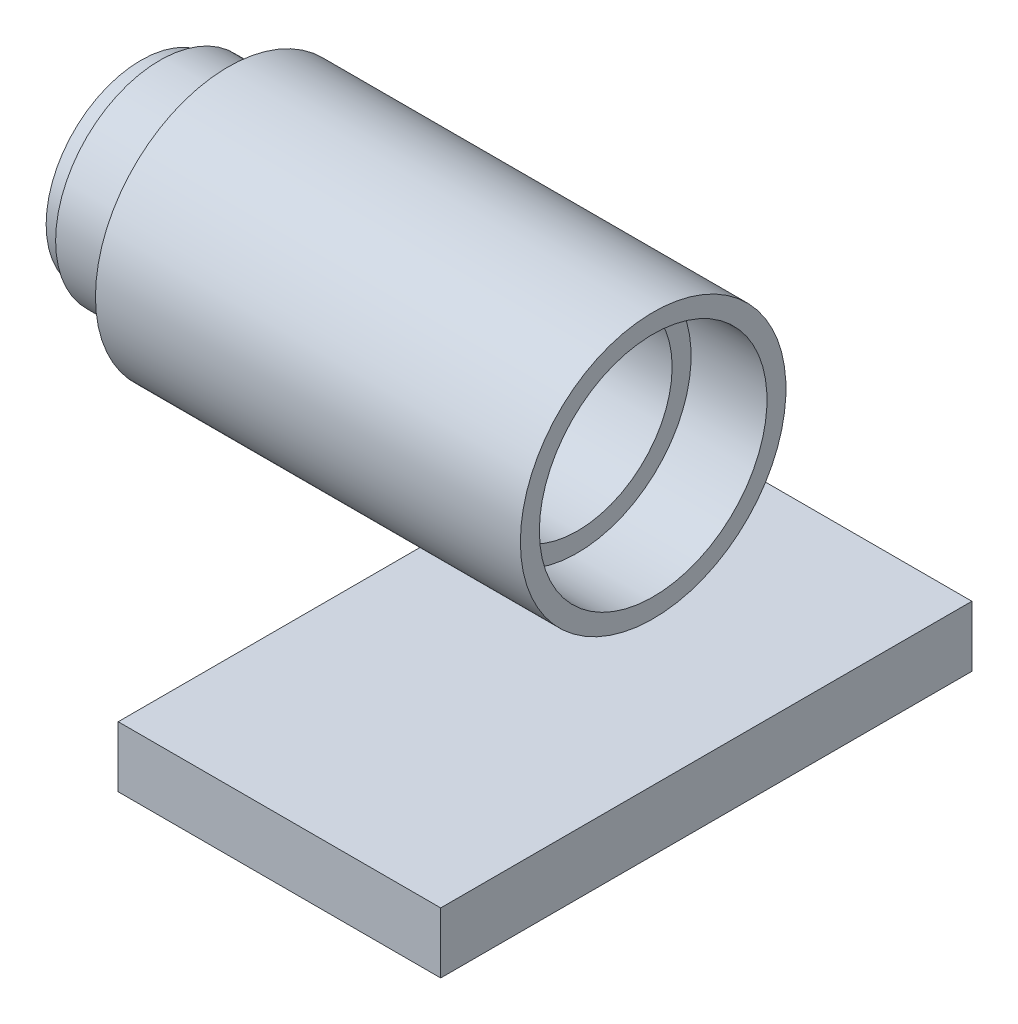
SolidWorks part; units mm, degrees
ref_plane "前视基准面" through (0, 0, 0) normal (0, 0, 1) x (1, 0, 0)
ref_plane "上视基准面" through (0, 0, 0) normal (0, 1, 0) x (1, 0, 0)
ref_plane "右视基准面" through (0, 0, 0) normal (1, 0, 0) x (0, 0, -1)
sketch "草图1" plane through (0, 0, 0) normal (0, 0, 1) x (1, 0, 0)
  line L0 (0, 0) -> (0, 16)
  line L1 (0, 16) -> (-85, 16)
  line L2 (-85, 16) -> (-85, 0)
  line L3 (-85, 0) -> (0, 0)
  dimension "D1" = 85
  dimension "D2" = 16
extrude "凸台-拉伸2" add sketch "草图1" along normal mid plane 140
ref_plane "基准面1" through (-14, 0, 0) normal (1, 0, 0) x (0, 0, -1)
sketch "草图2" plane through (0, 0, 0) normal (0, 0, 1) x (1, 0, 0)
  line L0 (-107.0679, 75) -> (-6.4484, 75) construction
  line L1 (-149, 91) -> (-149, 100)
  line L2 (-149, 100) -> (-144, 100)
  line L3 (-144, 100) -> (-144, 102.5)
  line L4 (-144, 102.5) -> (-126, 102.5)
  line L5 (-126, 102.5) -> (-126, 110)
  line L6 (-126, 110) -> (-14, 110)
  line L7 (-14, -8.8) -> (-14, 8.8) construction
  line L8 (-14, 110) -> (-14, 105)
  line L9 (-34, 100) -> (-114, 100)
  line L10 (-114, 100) -> (-114, 91)
  line L11 (-114, 91) -> (-149, 91)
  line L13 (-34, 100) -> (-34, 105)
  line L14 (-34, 105) -> (-14, 105)
  dimension "D1" = 35
  dimension "D2" = 30
  dimension "D3" = 25
  dimension "D4" = 18
  dimension "D5" = 112
  dimension "D6" = 135
  dimension "D7" = 20
  dimension "D8" = 80
  dimension "D9" = 16
  dimension "D10" = 75
  dimension "D11" = 25
  dimension "D12" = 27.5
revolve "旋转2" add sketch "草图2" angle 360 about L0
ref_plane "基准面2" through (-18, 0, 0) normal (1, 0, 0) x (0, 0, -1)
sketch "草图3" plane through (-18, 0, 0) normal (1, 0, 0) x (0, 0, -1)
  line L0 (0, -12.8905) -> (0, 132.0575) construction
  line L1 (77.2721, 75) -> (-87.1296, 75) construction
  line L2 (-50, 105.8207) -> (-50, 42.5784) construction
  line L3 (-70, 16) -> (-42.5982, 43.4018)
  line L4 (-70, 16) -> (70, 16) construction
  line L5 (-70, 16) -> (70, 16)
  line L6 (70, 16) -> (42.5982, 43.4018)
  circle A0 centre (-50, 75) radius 6
  arc A1 (-48.792, 57.0406) -> (-62.8571, 87.5974) centre (-50, 75) cw
  arc A2 (-42.5982, 43.4018) -> (-48.792, 57.0406) centre (-48.2551, 49.0586) ccw
  arc A3 (42.5982, 43.4018) -> (48.792, 57.0406) centre (48.2551, 49.0586) cw
  circle A4 centre (50, 75) radius 6
  arc A5 (48.792, 57.0406) -> (62.8571, 87.5974) centre (50, 75) ccw
  arc A6 (-62.8571, 87.5974) -> (62.8571, 87.5974) centre (0, 26.0102) cw
  circle A7 centre (0, 75) radius 35
  dimension "D2" = 12
  dimension "D3" = 18
  dimension "D4" = 8
  dimension "D6" = 88
  dimension "D7" = 70
  dimension "D1" = 50
  dimension "D5" = 45
